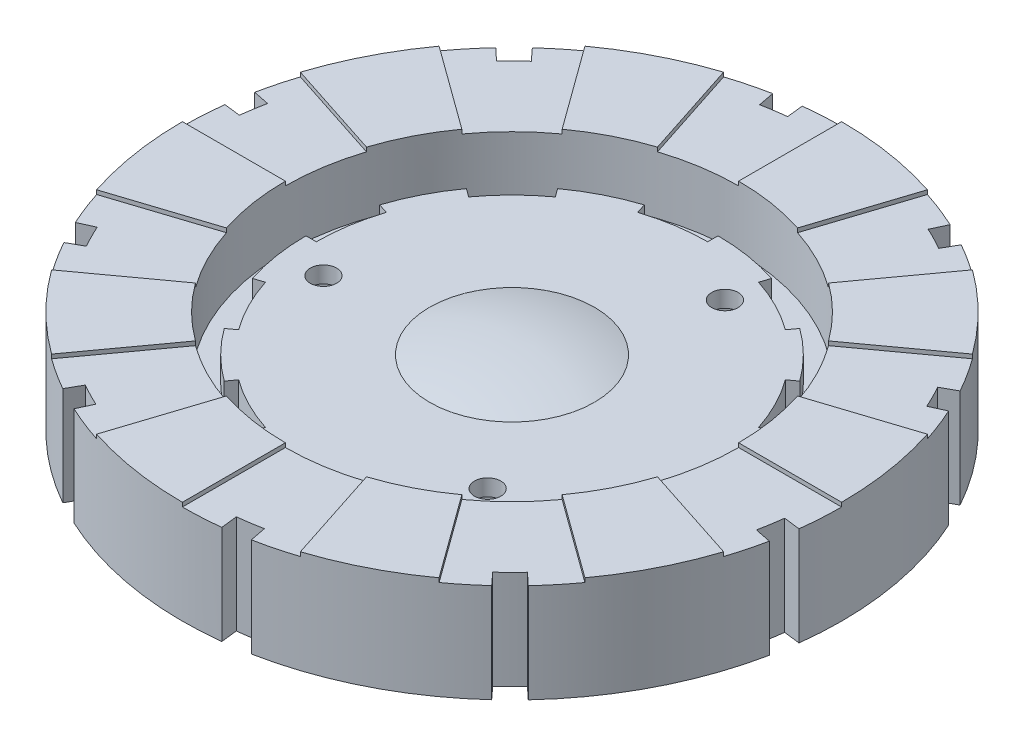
SolidWorks part; units mm, degrees
ref_plane "Front Plane" through (0, 0, 0) normal (0, 0, 1) x (1, 0, 0)
ref_plane "Top Plane" through (0, 0, 0) normal (0, 1, 0) x (1, 0, 0)
ref_plane "Right Plane" through (0, 0, 0) normal (1, 0, 0) x (0, 0, -1)
sketch "Sketch1" plane through (0, 0, 0) normal (0, 1, 0) x (1, 0, 0)
  circle A0 centre (0, 0) radius 40
  dimension "D1" = 80
extrude "Boss-Extrude1" add sketch "Sketch1" along normal blind 5
sketch "Sketch2" plane through (0, 5, 0) normal (0, 1, 0) x (1, 0, 0)
  circle A0 centre (0, 0) radius 40
  circle A1 centre (0, 0) radius 27.5
  circle A2 centre (0, 0) radius 40 construction
  dimension "D1" = 12.5
extrude "Boss-Extrude2" add sketch "Sketch2" along normal blind 7.5
sketch "Sketch3" plane through (0, 5, 0) normal (0, 1, 0) x (1, 0, 0)
  circle A0 centre (0, 0) radius 23.75
  dimension "D1" = 47.5
extrude "Boss-Extrude3" add sketch "Sketch3" along normal blind 5
sketch "Sketch4" plane through (0, 10, 0) normal (0, 1, 0) x (1, 0, 0)
  circle A0 centre (0, 0) radius 10
extrude "Cut-Extrude1" cut sketch "Sketch4" against normal blind 2
sketch "Sketch5" plane through (0, 8, 0) normal (0, 1, 0) x (1, 0, 0)
  circle A0 centre (0, 0) radius 7
extrude "Cut-Extrude2" cut sketch "Sketch5" against normal blind 2
sketch "Sketch6" plane through (0, 12.5, 0) normal (0, 1, 0) x (1, 0, 0)
  line L0 (0, 0) -> (0, 40)
  line L1 (0, 0) -> (12.3607, 38.0423)
  line L2 (0, 0) -> (23.5114, 32.3607)
  line L3 (0, 0) -> (32.3607, 23.5114)
  line L4 (0, 0) -> (38.0423, 12.3607)
  line L5 (0, 0) -> (40, 0)
  line L6 (0, 0) -> (38.0423, -12.3607)
  line L7 (0, 0) -> (32.3607, -23.5114)
  line L8 (0, 0) -> (23.5114, -32.3607)
  line L9 (0, 0) -> (12.3607, -38.0423)
  line L10 (0, 0) -> (0, -40)
  line L11 (0, 0) -> (-12.3607, -38.0423)
  line L12 (0, 0) -> (-23.5114, -32.3607)
  line L13 (0, 0) -> (-32.3607, -23.5114)
  line L14 (0, 0) -> (-38.0423, -12.3607)
  line L15 (0, 0) -> (-40, 0)
  line L16 (0, 0) -> (-38.0423, 12.3607)
  line L17 (0, 0) -> (-32.3607, 23.5114)
  line L18 (0, 0) -> (-23.5114, 32.3607)
  line L19 (0, 0) -> (-12.3607, 38.0423)
  circle A0 centre (0, 0) radius 40 construction
  dimension "D1" = 20
sketch "Sketch7" plane through (0, 10, 0) normal (0, 1, 0) x (1, 0, 0)
  line L0 (0, 0) -> (0, 40) construction
  line L1 (0, 0) -> (12.3607, 38.0423) construction
  line L2 (0, 0) -> (23.5114, 32.3607) construction
  line L3 (0, 0) -> (32.3607, 23.5114) construction
  line L4 (0, 0) -> (38.0423, 12.3607) construction
  line L5 (0, 0) -> (40, 0) construction
  line L6 (0, 0) -> (38.0423, -12.3607) construction
  line L7 (0, 0) -> (32.3607, -23.5114) construction
  line L8 (0, 0) -> (23.5114, -32.3607) construction
  line L9 (0, 0) -> (12.3607, -38.0423) construction
  line L10 (0, 0) -> (0, -40) construction
  line L11 (0, 0) -> (-12.3607, -38.0423) construction
  line L12 (0, 0) -> (-23.5114, -32.3607) construction
  line L13 (0, 0) -> (-32.3607, -23.5114) construction
  line L14 (0, 0) -> (-38.0423, -12.3607) construction
  line L15 (0, 0) -> (-40, 0) construction
  line L16 (0, 0) -> (-38.0423, 12.3607) construction
  line L17 (0, 0) -> (-32.3607, 23.5114) construction
  line L18 (0, 0) -> (-23.5114, 32.3607) construction
  line L19 (0, 0) -> (-12.3607, 38.0423) construction
  line L20 (0, 10) -> (0, 25)
  line L21 (3.0902, 9.5106) -> (7.7254, 23.7764)
  line L22 (5.8779, 8.0902) -> (14.6946, 20.2254)
  line L23 (8.0902, 5.8779) -> (20.2254, 14.6946)
  line L24 (9.5106, 3.0902) -> (23.7764, 7.7254)
  line L25 (10, 0) -> (25, 0)
  line L26 (9.5106, -3.0902) -> (23.7764, -7.7254)
  line L27 (8.0902, -5.8779) -> (20.2254, -14.6946)
  line L28 (5.8779, -8.0902) -> (14.6946, -20.2254)
  line L29 (3.0902, -9.5106) -> (7.7254, -23.7764)
  line L30 (0, -10) -> (0, -25)
  line L31 (-3.0902, -9.5106) -> (-7.7254, -23.7764)
  line L32 (-5.8779, -8.0902) -> (-14.6946, -20.2254)
  line L33 (-8.0902, -5.8779) -> (-20.2254, -14.6946)
  line L34 (-9.5106, -3.0902) -> (-23.7764, -7.7254)
  line L35 (-10, 0) -> (-25, 0)
  line L36 (-9.5106, 3.0902) -> (-23.7764, 7.7254)
  line L37 (-8.0902, 5.8779) -> (-20.2254, 14.6946)
  line L38 (-5.8779, 8.0902) -> (-14.6946, 20.2254)
  line L39 (-3.0902, 9.5106) -> (-7.7254, 23.7764)
  circle A0 centre (0, 0) radius 10 construction
  arc A1 (-3.0902, 9.5106) -> (-5.8779, 8.0902) centre (0, 0) ccw
  arc A2 (-7.7254, 23.7764) -> (-14.6946, 20.2254) centre (0, 0) ccw
  arc A3 (7.7254, 23.7764) -> (0, 25) centre (0, 0) ccw
  arc A4 (3.0902, 9.5106) -> (0, 10) centre (0, 0) ccw
  arc A5 (20.2254, 14.6946) -> (14.6946, 20.2254) centre (0, 0) ccw
  arc A6 (8.0902, 5.8779) -> (5.8779, 8.0902) centre (0, 0) ccw
  arc A7 (25, 0) -> (23.7764, 7.7254) centre (0, 0) ccw
  arc A8 (10, 0) -> (9.5106, 3.0902) centre (0, 0) ccw
  arc A9 (20.2254, -14.6946) -> (23.7764, -7.7254) centre (0, 0) ccw
  arc A10 (8.0902, -5.8779) -> (9.5106, -3.0902) centre (0, 0) ccw
  arc A11 (7.7254, -23.7764) -> (14.6946, -20.2254) centre (0, 0) ccw
  arc A12 (3.0902, -9.5106) -> (5.8779, -8.0902) centre (0, 0) ccw
  arc A13 (-7.7254, -23.7764) -> (0, -25) centre (0, 0) ccw
  arc A14 (-3.0902, -9.5106) -> (0, -10) centre (0, 0) ccw
  arc A15 (-20.2254, -14.6946) -> (-14.6946, -20.2254) centre (0, 0) ccw
  arc A16 (-8.0902, -5.8779) -> (-5.8779, -8.0902) centre (0, 0) ccw
  arc A17 (-25, 0) -> (-23.7764, -7.7254) centre (0, 0) ccw
  arc A18 (-10, 0) -> (-9.5106, -3.0902) centre (0, 0) ccw
  arc A19 (-20.2254, 14.6946) -> (-23.7764, 7.7254) centre (0, 0) ccw
  arc A20 (-8.0902, 5.8779) -> (-9.5106, 3.0902) centre (0, 0) ccw
  dimension "D1" = 50
extrude "Boss-Extrude4" add sketch "Sketch7" along normal blind 1 and the other way up to surface
sketch "Sketch8" plane through (0, 12.5, 0) normal (0, 1, 0) x (1, 0, 0)
  line L0 (0, 0) -> (-7.6324, 39.2651) construction
  line L1 (0, 0) -> (-4.5281, 39.7429) construction
  line L2 (0, 0) -> (-12.3607, 38.0423) construction
  line L3 (-7.2507, 37.3018) -> (-7.6324, 39.2651)
  line L4 (-4.3017, 37.7557) -> (-4.5281, 39.7429)
  circle A0 centre (0, 0) radius 40 construction
  arc A1 (-4.5281, 39.7429) -> (-7.6324, 39.2651) centre (0, 0) ccw
  arc A2 (-4.3017, 37.7557) -> (-7.2507, 37.3018) centre (0, 0) ccw
  dimension "D1" = 2
  dimension "D2" = 7
  dimension "D3" = 4.5
extrude "Cut-Extrude3" cut sketch "Sketch8" against normal up to surface (12.5 mm away)
pattern_circular "CirPattern1" count 10 every 36 about axis through (0, 0, 0) along (0, 1, 0) of "Cut-Extrude3"
chamfer "Chamfer1" distance 2 angle 45 1 edges at (0, 6, 7)
sketch "Sketch10" plane through (0, 12.5, 0) normal (0, 1, 0) x (1, 0, 0)
  line L0 (0, 0) -> (-40, 0) construction
  line L1 (-27.5, 0) -> (-40, 0)
  line L2 (0, 0) -> (-38.0423, 12.3607) construction
  line L3 (0, 0) -> (-32.3607, 23.5114) construction
  line L4 (0, 0) -> (-23.5114, 32.3607) construction
  line L5 (0, 0) -> (-12.3607, 38.0423) construction
  line L6 (0, 0) -> (0, 40) construction
  line L7 (0, 0) -> (12.3607, 38.0423) construction
  line L8 (0, 0) -> (23.5114, 32.3607) construction
  line L9 (0, 0) -> (32.3607, 23.5114) construction
  line L10 (0, 0) -> (38.0423, 12.3607) construction
  line L11 (0, 0) -> (40, 0) construction
  line L12 (0, 0) -> (38.0423, -12.3607) construction
  line L13 (0, 0) -> (32.3607, -23.5114) construction
  line L14 (0, 0) -> (23.5114, -32.3607) construction
  line L15 (0, 0) -> (12.3607, -38.0423) construction
  line L16 (0, 0) -> (0, -40) construction
  line L17 (0, 0) -> (-12.3607, -38.0423) construction
  line L18 (0, 0) -> (-23.5114, -32.3607) construction
  line L19 (0, 0) -> (-32.3607, -23.5114) construction
  line L20 (0, 0) -> (-38.0423, -12.3607) construction
  line L21 (-26.1541, 8.498) -> (-38.0423, 12.3607)
  line L22 (-22.248, 16.1641) -> (-32.3607, 23.5114)
  line L23 (-16.1641, 22.248) -> (-23.5114, 32.3607)
  line L24 (-8.498, 26.1541) -> (-12.3607, 38.0423)
  line L25 (0, 27.5) -> (0, 40)
  line L26 (8.498, 26.1541) -> (12.3607, 38.0423)
  line L27 (16.1641, 22.248) -> (23.5114, 32.3607)
  line L28 (22.248, 16.1641) -> (32.3607, 23.5114)
  line L29 (26.1541, 8.498) -> (38.0423, 12.3607)
  line L30 (27.5, 0) -> (40, 0)
  line L31 (26.1541, -8.498) -> (38.0423, -12.3607)
  line L32 (22.248, -16.1641) -> (32.3607, -23.5114)
  line L33 (16.1641, -22.248) -> (23.5114, -32.3607)
  line L34 (8.498, -26.1541) -> (12.3607, -38.0423)
  line L35 (0, -27.5) -> (0, -40)
  line L36 (-8.498, -26.1541) -> (-12.3607, -38.0423)
  line L37 (-16.1641, -22.248) -> (-23.5114, -32.3607)
  line L38 (-22.248, -16.1641) -> (-32.3607, -23.5114)
  line L39 (-26.1541, -8.498) -> (-38.0423, -12.3607)
  arc A0 (-26.1541, 8.498) -> (-27.5, 0) centre (0, 0) ccw
  arc A1 (-38.0423, 12.3607) -> (-40, 0) centre (0, 0) ccw
  circle A2 centre (0, 0) radius 27.5 construction
  circle A3 centre (0, 0) radius 40 construction
  arc A4 (-23.5114, 32.3607) -> (-32.3607, 23.5114) centre (0, 0) ccw
  arc A5 (-16.1641, 22.248) -> (-22.248, 16.1641) centre (0, 0) ccw
  arc A6 (0, 40) -> (-12.3607, 38.0423) centre (0, 0) ccw
  arc A7 (0, 27.5) -> (-8.498, 26.1541) centre (0, 0) ccw
  arc A8 (23.5114, 32.3607) -> (12.3607, 38.0423) centre (0, 0) ccw
  arc A9 (16.1641, 22.248) -> (8.498, 26.1541) centre (0, 0) ccw
  arc A10 (26.1541, 8.498) -> (22.248, 16.1641) centre (0, 0) ccw
  arc A11 (38.0423, 12.3607) -> (32.3607, 23.5114) centre (0, 0) ccw
  arc A12 (26.1541, -8.498) -> (27.5, 0) centre (0, 0) ccw
  arc A13 (38.0423, -12.3607) -> (40, 0) centre (0, 0) ccw
  arc A14 (16.1641, -22.248) -> (22.248, -16.1641) centre (0, 0) ccw
  arc A15 (23.5114, -32.3607) -> (32.3607, -23.5114) centre (0, 0) ccw
  arc A16 (0, -27.5) -> (8.498, -26.1541) centre (0, 0) ccw
  arc A17 (0, -40) -> (12.3607, -38.0423) centre (0, 0) ccw
  arc A18 (-16.1641, -22.248) -> (-8.498, -26.1541) centre (0, 0) ccw
  arc A19 (-23.5114, -32.3607) -> (-12.3607, -38.0423) centre (0, 0) ccw
  arc A20 (-26.1541, -8.498) -> (-22.248, -16.1641) centre (0, 0) ccw
  arc A21 (-38.0423, -12.3607) -> (-32.3607, -23.5114) centre (0, 0) ccw
extrude "Cut-Extrude4" cut sketch "Sketch10" against normal blind 0.5
sketch "Sketch11" plane through (0, 0, 0) normal (0, -1, 0) x (1, 0, 0)
  line L0 (0, 0) -> (32.6872, 5.1771) construction
  line L1 (0, 0) -> (58.1411, 0) construction
  circle A0 centre (32.6872, 5.1771) radius 2.65
  dimension "D1" = 5.3
  dimension "D2" = 9
extrude "Cut-Extrude5" cut sketch "Sketch11" against normal blind 7.64
fillet "Fillet1" radius 2.2 1 edges at (32.6872, 7.64, 2.5271)
pattern_circular "CirPattern2" count 20 every 18 about axis through (0, 0, 0) along (0, 1, 0) of "Cut-Extrude5", "Fillet1"
sketch "Sketch12" plane through (0, 0, 0) normal (0, -1, 0) x (1, 0, 0)
  line L0 (0, 0) -> (4.5, 0) construction
  circle A0 centre (4.5, 0) radius 2.65
  circle A1 centre (-4.5, 0) radius 2.65
  circle A2 centre (0, 4.5) radius 2.65
  circle A3 centre (0, -4.5) radius 2.65
  dimension "D1" = 5.3
  dimension "D2" = 5.3
  dimension "D3" = 5.3
  dimension "D4" = 5.3
  dimension "D5" = 4.5
  dimension "D6" = 4.5
  dimension "D7" = 4.5
  dimension "D8" = 4.5
sketch "Sketch15" plane through (0, 8, 0) normal (0, 1, 0) x (1, 0, 0)
  circle A0 centre (0, 0) radius 7
extrude "Boss-Extrude6" add sketch "Sketch15" against normal up to surface (2 mm away)
extrude "Cut-Extrude7" cut sketch "Sketch12" against normal blind 7.7
fillet "Fillet2" radius 2.1 4 edges at (0, 7.7, -7.15) (4.5, 7.7, -2.65) (0, 7.7, 1.85) (-4.5, 7.7, -2.65)
sketch "Sketch21" plane through (0, 0, 0) normal (1, 0, 0) x (0, 0, -1)
  line L0 (0, 0) -> (0, 9.5) construction
  line L1 (10, 8) -> (-10, 8) construction
  line L2 (0, 9.5) -> (0, 8)
  line L3 (0, 8) -> (10, 8)
  line L4 (0, 9.5) -> (4.6632, 9.5) construction
  arc A0 (0, 9.5) -> (10, 8) centre (0, -24.5833) cw
  dimension "D1" = 1.5
  dimension "D2" = 10
revolve "Revolve1" add sketch "Sketch21" angle 360 about L0
sketch "Sketch22" plane through (0, 11, 0) normal (0, 1, 0) x (1, 0, 0)
  circle A0 centre (0, 0) radius 10
  circle A1 centre (0, 0) radius 25
extrude "Cut-Extrude12" cut sketch "Sketch22" against normal blind 3
sketch "Sketch25" plane through (0, 8, 0) normal (0, 1, 0) x (1, 0, 0)
  line L0 (-19.7538, -3.1287) -> (0, 0) construction
  line L1 (-19.7538, -3.1287) -> (-24.6922, -3.9109) construction
  circle A0 centre (-19.7538, -3.1287) radius 1.6
  arc A2 (-25, 0) -> (-23.7764, -7.7254) centre (0, 0) ccw construction
  circle A3 centre (0, 0) radius 10 construction
  dimension "D1" = 3.2
  dimension "D2" = 20
extrude "Cut-Extrude14" cut sketch "Sketch25" against normal blind 10
pattern_circular "CirPattern3" count 3 over 360 about axis through (0, 0, 0) along (0, 1, 0) of "Cut-Extrude14"
sketch "Sketch26" plane through (0, 0, 0) normal (0, -1, 0) x (1, 0, 0)
  line L0 (0, 0) -> (-16.7907, 2.6594) construction
  line L1 (-19.2119, 6.5501) -> (-22.4459, 5.3087)
  line L2 (-22.4459, 5.3087) -> (-22.9878, 1.8873)
  line L3 (-22.9878, 1.8873) -> (-20.2957, -0.2928)
  line L4 (-20.2957, -0.2928) -> (-17.0617, 0.9487)
  line L5 (-17.0617, 0.9487) -> (-16.5197, 4.3701)
  line L6 (-16.5197, 4.3701) -> (-19.2119, 6.5501)
  circle A0 centre (-19.7538, 3.1287) radius 3 construction
  dimension "D1" = 6
extrude "Cut-Extrude15" cut sketch "Sketch26" against normal offset from surface (6 mm away) 2
pattern_circular "CirPattern4" count 3 over 360 about axis through (0, 0, 0) along (0, 1, 0) of "Cut-Extrude15"
